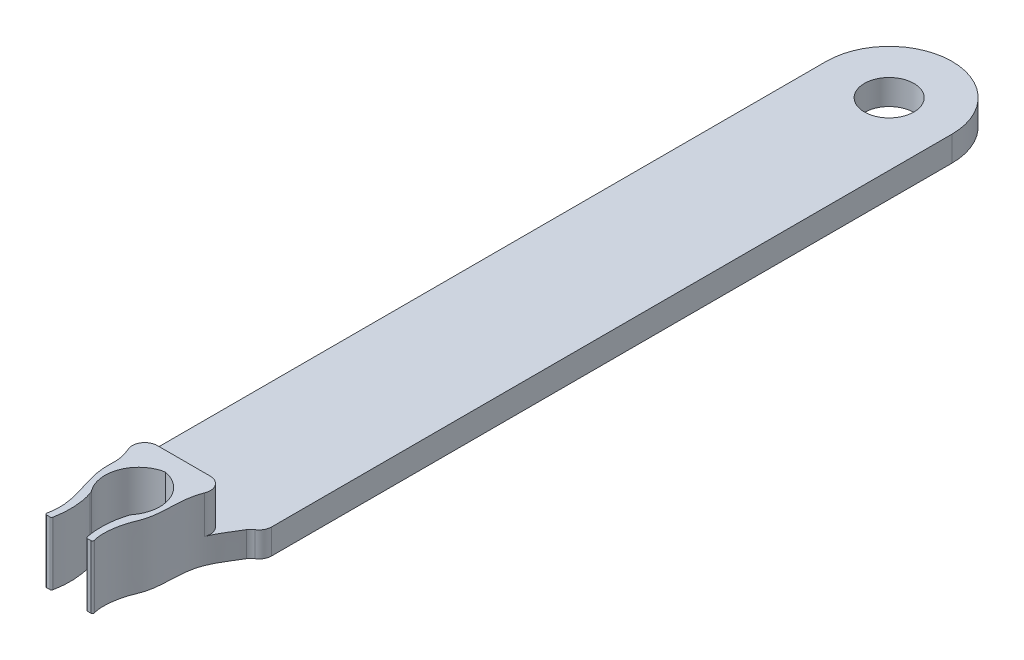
SolidWorks part; units mm, degrees
ref_plane "Front Plane" through (0, 0, 0) normal (0, 0, 1) x (1, 0, 0)
ref_plane "Top Plane" through (0, 0, 0) normal (0, 1, 0) x (1, 0, 0)
ref_plane "Right Plane" through (0, 0, 0) normal (1, 0, 0) x (0, 0, -1)
sketch "Sketch1" plane through (0, 0, 0) normal (0, 1, 0) x (1, 0, 0)
  line L0 (0, 12.7) -> (0, -18.5764) construction
  line L1 (-4.4511, -32.1986) -> (-3.776, -32.1986)
  line L2 (4.4511, -32.1986) -> (3.776, -32.1986)
  arc A0 (-12.6901, -0.502) -> (12.6901, -0.502) centre (0, 0) cw
  circle A1 centre (0, 0) radius 2.54
  arc A2 (-12.6901, -0.502) -> (12.6901, -0.502) centre (0, 0) ccw construction
  arc A3 (0, -12.7) -> (-4.2124, -23.3606) centre (1.256, -19.3588) ccw
  arc A4 (-4.2124, -23.3606) -> (-3.8349, -24.1124) centre (-6.2622, -24.8607) cw
  arc A5 (-3.4519, -31.9324) -> (-3.776, -32.1986) centre (-3.776, -31.8683) cw
  arc A6 (-4.7735, -31.7962) -> (-4.4511, -32.1986) centre (-4.4511, -31.8683) ccw
  arc A7 (4.7735, -31.7962) -> (4.4511, -32.1986) centre (4.4511, -31.8683) cw
  arc A8 (3.4519, -31.9324) -> (3.776, -32.1986) centre (3.776, -31.8683) ccw
  arc A9 (4.2124, -23.3606) -> (3.8349, -24.1124) centre (6.2622, -24.8607) ccw
  arc A10 (0, -12.7) -> (4.2124, -23.3606) centre (-1.256, -19.3588) cw
  spline S0 degree 3 poles (-12.6901, -0.502) (-12.7086, -0.5346) (-12.9445, -3.8187) (-6.4425, -13.8865) (-7.3603, -18.4592) (-5.2739, -24.7591) (-4.156, -29.0329) (-4.7735, -31.7962) knots 0 0 0 0 0.279659 0.433864 0.566787 0.759909 0.988954 0.988954 0.988954 0.988954
  spline S1 degree 3 poles (-3.8349, -24.1124) (-3.6668, -24.6575) (-3.0286, -27.202) (-3.0384, -29.8419) (-3.4519, -31.9324) knots 0.055076 0.055076 0.055076 0.055076 0.252507 0.96957 0.96957 0.96957 0.96957
  spline S2 degree 3 poles (3.8349, -24.1124) (3.6668, -24.6575) (3.0286, -27.202) (3.0384, -29.8419) (3.4519, -31.9324) knots 0.055076 0.055076 0.055076 0.055076 0.252507 0.96957 0.96957 0.96957 0.96957
  spline S3 degree 3 poles (12.6901, -0.502) (12.8342, -5.638) (5.4885, -11.2875) (7.0856, -20.9954) (4.5252, -26.6602) (4.2626, -30.148) (4.7735, -31.7962) knots 0 0 0 0 0.420411 0.703009 0.760968 1 1 1 1
  dimension "D1" = 12.7
  dimension "D2" = 5.08
  dimension "D3" = 2.54
  dimension "D4" = 0.3304
extrude "Boss-Extrude1" add sketch "Sketch1" along normal blind 12.7
ref_plane "Plane1" through (0, 5.08, 0) normal (0, 1, 0) x (1, 0, 0)
ref_plane "Plane4" through (7.62, 0, 0) normal (1, 0, 0) x (0, 0, -1)
sketch "Sketch2" plane through (0, 5.08, 0) normal (0, 1, 0) x (1, 0, 0)
  line L0 (-12.7, 0) -> (-12.7, -8.89)
  line L1 (-12.7, -8.89) -> (12.7, -8.89)
  line L2 (12.7, -8.89) -> (12.7, 0)
  arc A0 (-12.7, 0) -> (12.7, 0) centre (0, 0) cw
  arc A1 (12.6901, -0.502) -> (-12.6901, -0.502) centre (0, 0) ccw construction
  dimension "D1" = 8.89
extrude "Cut-Extrude1" cut sketch "Sketch2" along normal up to next
fillet "Fillet1" radius 2.54 2 edges
sketch "Sketch3" plane through (0, 5.08, 0) normal (0, 1, 0) x (1, 0, 0)
  line L0 (-12.7, -6.35) -> (12.7, -6.35)
  line L1 (-12.7, -6.35) -> (-12.7, 133.35)
  line L2 (12.7, -6.35) -> (12.7, 133.35)
  arc A0 (-12.7, 133.35) -> (12.7, 133.35) centre (0, 133.35) cw
  dimension "D1" = 6.35
  dimension "D2" = 12.7
  dimension "D3" = 25.4
  dimension "D4" = 139.7
extrude "Boss-Extrude2" add sketch "Sketch3" against normal blind 5.08
fillet "Fillet2" radius 2.54 2 edges at (12.7, 2.54, 6.35) (-12.7, 2.54, 6.35)
fillet "Fillet3" radius 2.54 1 edges at (-10.9754, 2.54, 6.35)
fillet "Fillet4" radius 2.54 1 edges at (10.9914, 2.54, 6.35)
sketch "Sketch4" plane through (0, 5.08, 0) normal (0, 1, 0) x (1, 0, 0)
  circle A0 centre (0, 133.35) radius 5
  arc A1 (12.7, 133.35) -> (-12.7, 133.35) centre (0, 133.35) ccw construction
  dimension "D1" = 10
extrude "Cut-Extrude2" cut sketch "Sketch4" against normal blind 5.08
sketch "Sketch5" plane through (0, 12.7, 0) normal (0, 1, 0) x (1, 0, 0)
  circle A0 centre (0, -19.1833) radius 5.5081
